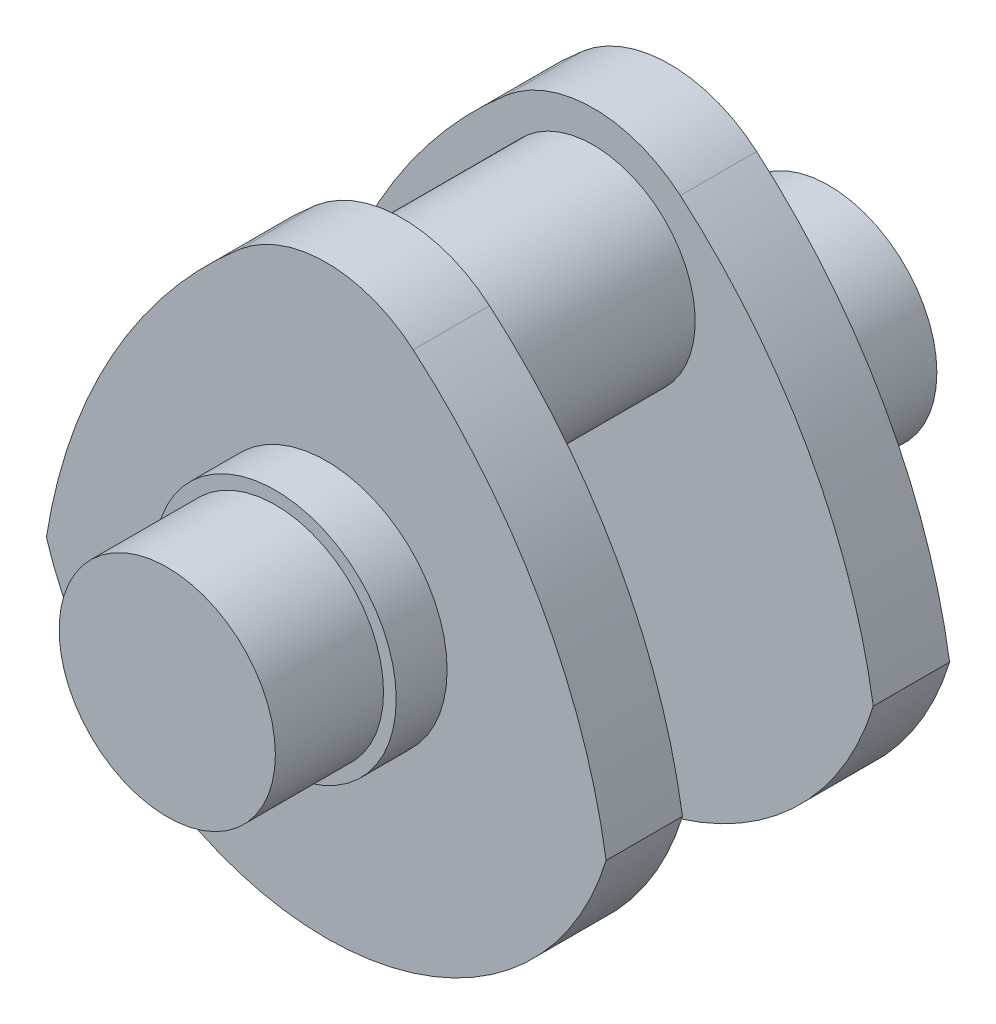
SolidWorks part; units mm, degrees
ref_plane "Front Plane" through (0, 0, 0) normal (0, 0, 1) x (1, 0, 0)
ref_plane "Top Plane" through (0, 0, 0) normal (0, 1, 0) x (1, 0, 0)
ref_plane "Right Plane" through (0, 0, 0) normal (1, 0, 0) x (0, 0, -1)
sketch "Sketch1" plane through (0, 0, 0) normal (0, 0, 1) x (1, 0, 0)
  circle A0 centre (0, 0) radius 17
  dimension "D1" = 34
extrude "Boss-Extrude1" add sketch "Sketch1" along normal blind 25
sketch "Sketch2" plane through (0, 0, 0) normal (0, 0, 1) x (1, 0, 0)
  circle A0 centre (0, 0) radius 19
  dimension "D1" = 38
extrude "Boss-Extrude3" add sketch "Sketch2" along normal blind 8
sketch "Sketch3" plane through (0, 0, 0) normal (0, 0, -1) x (-1, 0, 0)
  arc A0 (-44, -13.4164) -> (44, -13.4164) centre (0, 0) ccw
  arc A1 (13.6681, 40.9431) -> (-13.6681, 40.9431) centre (0, 25) ccw
  arc A2 (-13.6681, 40.9431) -> (-44, -13.4164) centre (44.9095, -27.3845) ccw
  arc A3 (13.6681, 40.9431) -> (44, -13.4164) centre (-44.9095, -27.3845) cw
  dimension "D2" = 46
  dimension "D3" = 42
  dimension "D5" = 90
  dimension "D6" = 90
  dimension "D1" = 88
  dimension "D4" = 25
extrude "Boss-Extrude4" add sketch "Sketch3" along normal blind 12
sketch "Sketch4" plane through (0, 0, -12) normal (0, 0, -1) x (-1, 0, 0)
  circle A0 centre (0, 25) radius 16
  dimension "D1" = 32
  dimension "D2" = 25
extrude "Boss-Extrude5" add sketch "Sketch4" along normal blind 15 contours A0
mirror "Mirror1" about plane through (0, 25, -27) normal (0, 0, -1)
